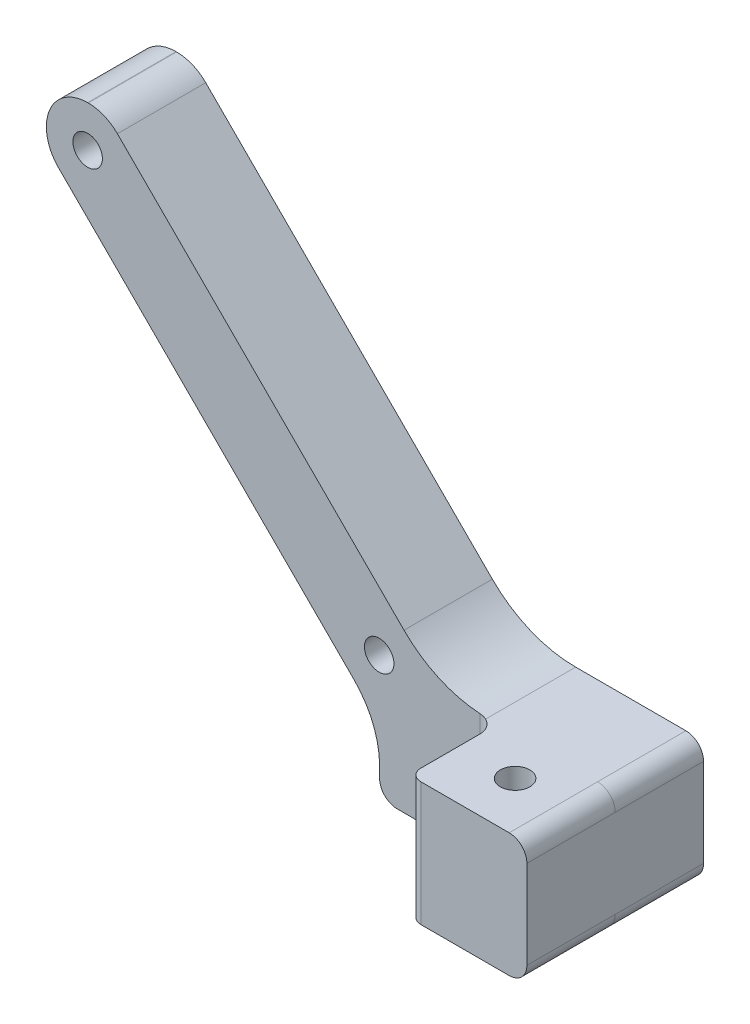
SolidWorks part; units mm, degrees
ref_plane "Front Plane" through (0, 0, 0) normal (0, 0, 1) x (1, 0, 0)
ref_plane "Top Plane" through (0, 0, 0) normal (0, 1, 0) x (1, 0, 0)
ref_plane "Right Plane" through (0, 0, 0) normal (1, 0, 0) x (0, 0, -1)
sketch "Sketch1" plane through (0, 0, 0) normal (0, 1, 0) x (1, 0, 0)
  line L1 (-20, 7.5) -> (20, 7.5)
  line L2 (-20, 7.5) -> (-20, -7.5)
  line L3 (-20, -7.5) -> (20, -7.5)
  line L4 (20, 7.5) -> (20, -7.5)
  line L5 (-20, 7.5) -> (20, -7.5) construction
  line L6 (-20, -7.5) -> (20, 7.5) construction
  point P0 (0, 0)
  dimension "D1" = 40
  dimension "D2" = 15
extrude "Boss-Extrude1" add sketch "Sketch1" along normal blind 21
sketch "Sketch2" plane through (0, 21, 0) normal (0, 1, 0) x (1, 0, 0)
  line L1 (-10, 7.5) -> (-20, 7.5)
  line L2 (-10, 7.5) -> (-10, -7.5)
  line L3 (-10, -7.5) -> (-20, -7.5)
  line L4 (-20, 7.5) -> (-20, -7.5)
  line L5 (-10, 7.5) -> (-20, -7.5) construction
  line L6 (-10, -7.5) -> (-20, 7.5) construction
  line L8 (0, 0) -> (-15, 0) construction
  line L9 (20, 7.5) -> (-20, 7.5) construction
  point P0 (-15, 0)
  dimension "D1" = 5
fillet "Fillet2" radius 3 3 edges at (20, 0, 0) (20, 21, 0) (-20, 0, 0)
sketch "Sketch6" plane through (0, 0, 0) normal (0, 0, 1) x (1, 0, 0)
  line L0 (-20, 21) -> (-76.5685, 77.5685)
  line L1 (-20, 21) -> (-20, 3) construction
  dimension "D1" = 135
  dimension "D2" = 80
sweep "Sweep1" add profiles "Sketch2" path "Sketch6"
sketch "Sketch7" plane through (-20, 0, 0) normal (-1, 0, 0) x (0, 0, 1)
  line L0 (7.5, 21) -> (7.5, 3) construction
  line L1 (-7.5, 21) -> (7.5, 21)
  line L2 (-7.5, 21) -> (-7.5, 11)
  line L3 (-7.5, 11) -> (7.5, 11)
  line L4 (7.5, 21) -> (7.5, 11)
  line L5 (-7.5, 21) -> (7.5, 11) construction
  line L6 (-7.5, 11) -> (7.5, 21) construction
  line L8 (-7.5, 21) -> (7.5, 21) construction
  line L9 (-7.5, 21) -> (-7.5, 3) construction
  point P0 (0, 16)
  dimension "D1" = 5
sweep "Sweep2" add profiles "Sketch7"
fillet "Fillet3" radius 7 3 edges at (-66.5685, 77.5685, 0) (-76.5685, 67.5685, 0) (-76.5685, 77.5685, 0)
fillet "Fillet4" radius 20 1 edges at (-10, 21, 0)
sketch "Sketch8" plane through (0, 0, 0) normal (0, 0, 1) x (1, 0, 0)
  circle A0 centre (-69.5685, 70.5685) radius 2.5
  dimension "D1" = 5
extrude "Cut-Extrude3" cut sketch "Sketch8" against normal mid plane 15
sketch "Sketch9" plane through (0, 0, 0) normal (0, 0, 1) x (1, 0, 0)
  line L0 (-69.5685, 70.5685) -> (-20.0711, 21.0711) construction
  line L1 (-20, 11) -> (-74.5183, 65.5183) construction
  circle A0 centre (-20.0711, 21.0711) radius 2.5
  circle A1 centre (-69.5685, 70.5685) radius 2.5 construction
  dimension "D1" = 5
  dimension "D270" = 70
extrude "Cut-Extrude4" cut sketch "Sketch9" against normal mid plane 60.1005
fillet "Fillet5" radius 15 1 edges at (-20, 11, 0)
sketch "Sketch10" plane through (0, 0, 7.5) normal (0, 0, 1) x (1, 0, 0)
  line L0 (20, 0) -> (20, 21)
  line L1 (20, 21) -> (0, 21)
  line L2 (-1.7157, 21) -> (17, 21) construction
  line L3 (0, 21) -> (0, 0)
  line L4 (0, 0) -> (20, 0)
  line L5 (20, 18) -> (20, 3) construction
extrude "Boss-Extrude2" add sketch "Sketch10" along normal blind 15
fillet "Fillet6" radius 3 2 edges at (20, 21, 15) (20, 0, 15)
fillet "Fillet7" radius 3 1 edges at (0, 10.5, 7.5)
fillet "Fillet8" radius 2 1 edges at (0, 10.5, 22.5)
sketch "Sketch13" plane through (0, 0, 0) normal (0, -1, 0) x (1, 0, 0)
  line L0 (9.5, 22.5) -> (9.5, 14) construction
  line L1 (2, 22.5) -> (17, 22.5) construction
  circle A0 centre (9.5, 14) radius 2.5
  dimension "D2" = 5
  dimension "D1" = 8.5
extrude "Cut-Extrude5" cut sketch "Sketch13" against normal through all
